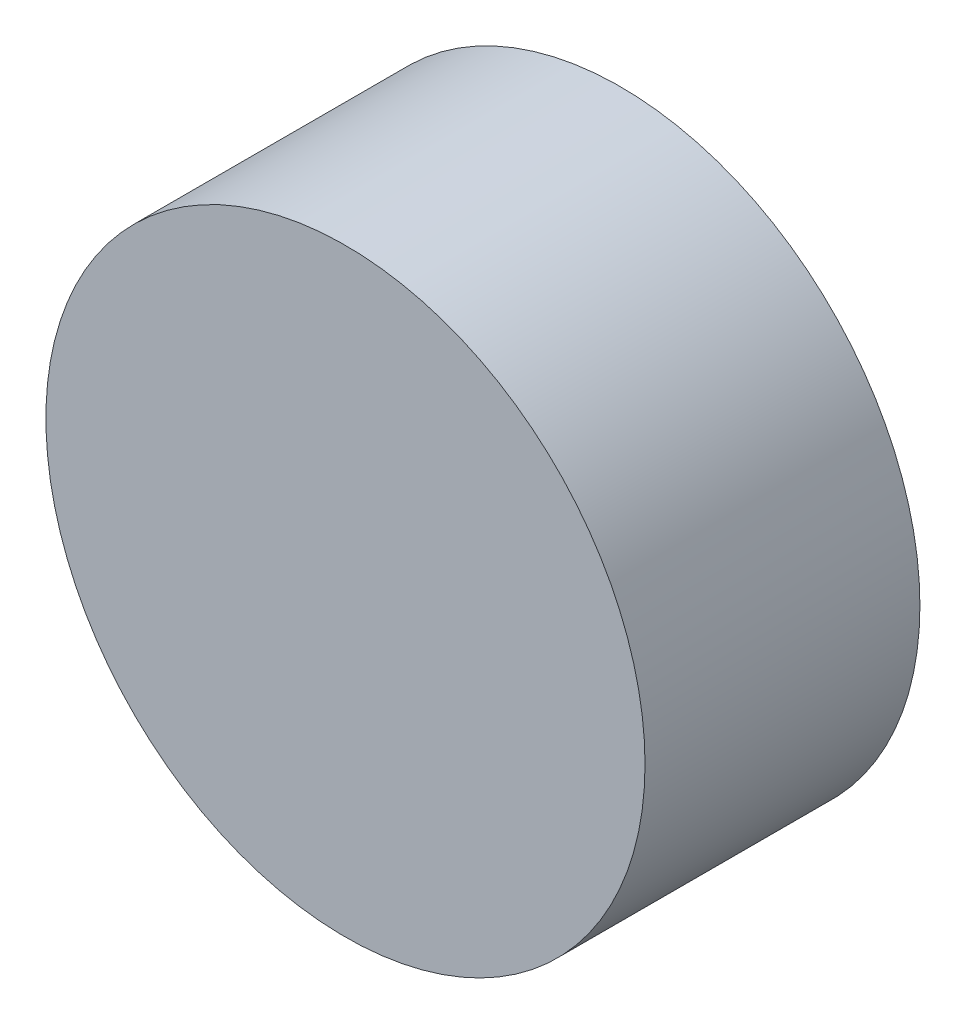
SolidWorks part; units mm, degrees
ref_plane "Face" through (0, 0, 0) normal (0, 0, 1) x (1, 0, 0)
ref_plane "Dessus" through (0, 0, 0) normal (0, 1, 0) x (1, 0, 0)
ref_plane "Droite" through (0, 0, 0) normal (1, 0, 0) x (0, 0, -1)
sketch "Esquisse1" plane through (0, 0, 0) normal (0, 0, 1) x (1, 0, 0)
  circle A0 centre (0, 0) radius 70
  dimension "D1" = 140
extrude "Extrusion1" add sketch "Esquisse1" along normal blind 6
sketch "Esquisse2" plane through (0, 0, 6) normal (0, 0, 1) x (1, 0, 0)
  circle A0 centre (0, 0) radius 85
  circle A1 centre (0, 0) radius 70 construction
  dimension "D1" = 170
extrude "Extrusion2" add sketch "Esquisse2" along normal blind 78
